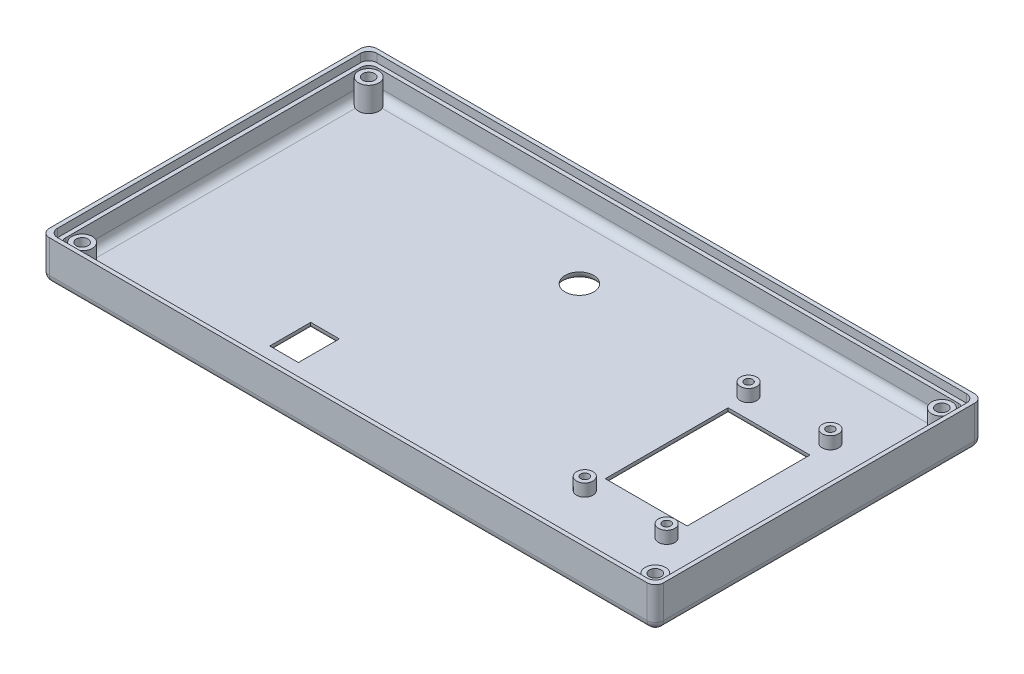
SolidWorks part; units mm, degrees
ref_plane "Front Plane" through (0, 0, 0) normal (0, 0, 1) x (1, 0, 0)
ref_plane "Top Plane" through (0, 0, 0) normal (0, 1, 0) x (1, 0, 0)
ref_plane "Right Plane" through (0, 0, 0) normal (1, 0, 0) x (0, 0, -1)
sketch "Sketch1" plane through (0, 0, 0) normal (0, 1, 0) x (1, 0, 0)
  line L1 (-75, 40) -> (75, 40)
  line L2 (-75, 40) -> (-75, -40)
  line L3 (-75, -40) -> (75, -40)
  line L4 (75, 40) -> (75, -40)
  line L5 (-75, 40) -> (75, -40) construction
  line L6 (-75, -40) -> (75, 40) construction
  point P0 (0, 0)
  dimension "D1" = 150
  dimension "D2" = 80
extrude "Boss-Extrude1" add sketch "Sketch1" along normal blind 10
sketch "Sketch2" plane through (0, 10, 0) normal (0, 1, 0) x (1, 0, 0)
  line L0 (-75, 40) -> (-75, -40) construction
  line L1 (-74, 39) -> (74, 39)
  line L2 (-74, 39) -> (-74, -39)
  line L3 (-74, -39) -> (74, -39)
  line L4 (74, 39) -> (74, -39)
  line L5 (-74, 39) -> (74, -39) construction
  line L6 (-74, -39) -> (74, 39) construction
  line L7 (75, 40) -> (-75, 40) construction
  point P0 (0, 0)
  dimension "D1" = 1
  dimension "D2" = 1
extrude "Cut-Extrude1" cut sketch "Sketch2" against normal blind 2
sketch "Sketch3" plane through (0, 8, 0) normal (0, 1, 0) x (1, 0, 0)
  line L0 (74, 39) -> (-74, 39) construction
  line L1 (-73, 38) -> (73, 38)
  line L2 (-73, 38) -> (-73, -38)
  line L3 (-73, -38) -> (73, -38)
  line L4 (73, 38) -> (73, -38)
  line L5 (-73, 38) -> (73, -38) construction
  line L6 (-73, -38) -> (73, 38) construction
  line L7 (-74, 39) -> (-74, -39) construction
  point P0 (0, 0)
  dimension "D1" = 1
  dimension "D2" = 1
extrude "Cut-Extrude2" cut sketch "Sketch3" against normal blind 6
sketch "Sketch4" plane through (0, 8, 0) normal (0, 1, 0) x (1, 0, 0)
  line L0 (73, 38) -> (-73, 38) construction
  line L1 (-73, 38) -> (-73, -38) construction
  line L2 (0, 0) -> (0, -23.2068) construction
  line L3 (0, 0) -> (29.0616, 0) construction
  circle A0 centre (-70, 35) radius 2.5
  circle A1 centre (70, 35) radius 2.5
  circle A2 centre (70, -35) radius 2.5
  circle A3 centre (-70, -35) radius 2.5
  dimension "D1" = 5
  dimension "D2" = 3
  dimension "D3" = 3
extrude "Boss-Extrude2" add sketch "Sketch4" against normal up to surface (6 mm away)
sketch "Sketch5" plane through (0, 8, 0) normal (0, 1, 0) x (1, 0, 0)
  line L0 (0, 0) -> (0, -21.9589) construction
  line L1 (0, 0) -> (25.257, 0) construction
  circle A0 centre (-70, 35) radius 1.4388
  circle A1 centre (70, 35) radius 1.4388
  circle A2 centre (70, -35) radius 1.4388
  circle A3 centre (-70, -35) radius 1.4388
extrude "Cut-Extrude3" cut sketch "Sketch5" against normal blind 3
sketch "Sketch6" plane through (0, 2, 0) normal (0, 1, 0) x (1, 0, 0)
  line L1 (37.8764, 14.9013) -> (57.8764, 14.9013)
  line L2 (37.8764, 14.9013) -> (37.8764, -15.0987)
  line L3 (37.8764, -15.0987) -> (57.8764, -15.0987)
  line L4 (57.8764, 14.9013) -> (57.8764, -15.0987)
  line L5 (37.8764, 14.9013) -> (57.8764, -15.0987) construction
  line L6 (37.8764, -15.0987) -> (57.8764, 14.9013) construction
  point P0 (47.8764, -0.0987)
  dimension "D1" = 20
  dimension "D2" = 30
extrude "Cut-Extrude4" cut sketch "Sketch6" against normal blind 3
sketch "Sketch7" plane through (0, 2, 0) normal (0, 1, 0) x (1, 0, 0)
  line L0 (73, 38) -> (-73, 38) construction
  line L1 (-31.1722, -18) -> (-24.1722, -18)
  line L2 (-31.1722, -18) -> (-31.1722, -28)
  line L3 (-31.1722, -28) -> (-24.1722, -28)
  line L4 (-24.1722, -18) -> (-24.1722, -28)
  line L5 (-73, -38) -> (73, -38) construction
  circle A0 centre (-6.5359, 23) radius 3.5
  dimension "D3" = 7
  dimension "D1" = 7
  dimension "D2" = 10
  dimension "D4" = 15
  dimension "D5" = 10
extrude "Cut-Extrude5" cut sketch "Sketch7" against normal blind 3
fillet "Fillet1" radius 2 11 edges at (0, 0, -40) (-75, 0, 0) (0, 0, 40) (75, 0, 0) (75, 5, 40) (75, 5, -40) (-75, 5, -40) (-75, 5, 40) (-73, 2, 0) (73, 2, 0) (0, 2, -38)
fillet "Fillet2" radius 2 13 edges at (-73, 6, 38) (-72.4142, 2.5858, 38) (0, 2, 38) (72.4142, 2.5858, 38) (72.6637, 2.8899, -37.6637) (-72.6637, 2.8899, -37.6637) (-74, 9, 39) (74, 9, 39) (73, 6, 38) (74, 9, -39) (73, 6, -38) (-74, 9, -39) (-73, 6, -38)
fillet "Fillet3" radius 2 9 edges at (-31.1722, 0, 23) (-27.6722, 0, 28) (-24.1722, 0, 23) (-27.6722, 0, 18) (-6.5359, 0, -19.5) (47.8764, 0, 15.0987) (57.8764, 0, 0.0987) (47.8764, 0, -14.9013) (37.8764, 0, 0.0987)
sketch "Sketch8" plane through (0, 2, 0) normal (0, 1, 0) x (1, 0, 0)
  line L0 (37.8764, -0.0987) -> (68.2809, -0.0987) construction
  line L1 (37.8764, 14.9013) -> (37.8764, -15.0987) construction
  line L2 (47.8764, 14.9013) -> (47.8764, 26.5359) construction
  line L3 (57.8764, 14.9013) -> (37.8764, 14.9013) construction
  circle A0 centre (37.8764, 19.9013) radius 2
  circle A1 centre (57.8764, 19.9013) radius 2
  circle A2 centre (57.8764, -20.0987) radius 2
  circle A3 centre (37.8764, -20.0987) radius 2
  point P18 (38.2195, -0.8152)
  dimension "D1" = 4
  dimension "D2" = 20
extrude "Boss-Extrude3" add sketch "Sketch8" along normal blind 3
sketch "Sketch11" plane through (0, 5, 0) normal (0, 1, 0) x (1, 0, 0)
  line L0 (37.8764, -0.0987) -> (28.7879, -0.0987) construction
  line L1 (37.8764, 14.9013) -> (37.8764, -15.0987) construction
  line L2 (47.8764, 14.9013) -> (47.8764, 24.3741) construction
  line L3 (57.8764, 14.9013) -> (37.8764, 14.9013) construction
  circle A0 centre (37.8764, 19.9013) radius 1
  circle A1 centre (37.8764, -20.0987) radius 1
  circle A2 centre (57.8764, -20.0987) radius 1
  circle A3 centre (57.8764, 19.9013) radius 1
  dimension "D1" = 2
extrude "Cut-Extrude6" cut sketch "Sketch11" against normal blind 3
